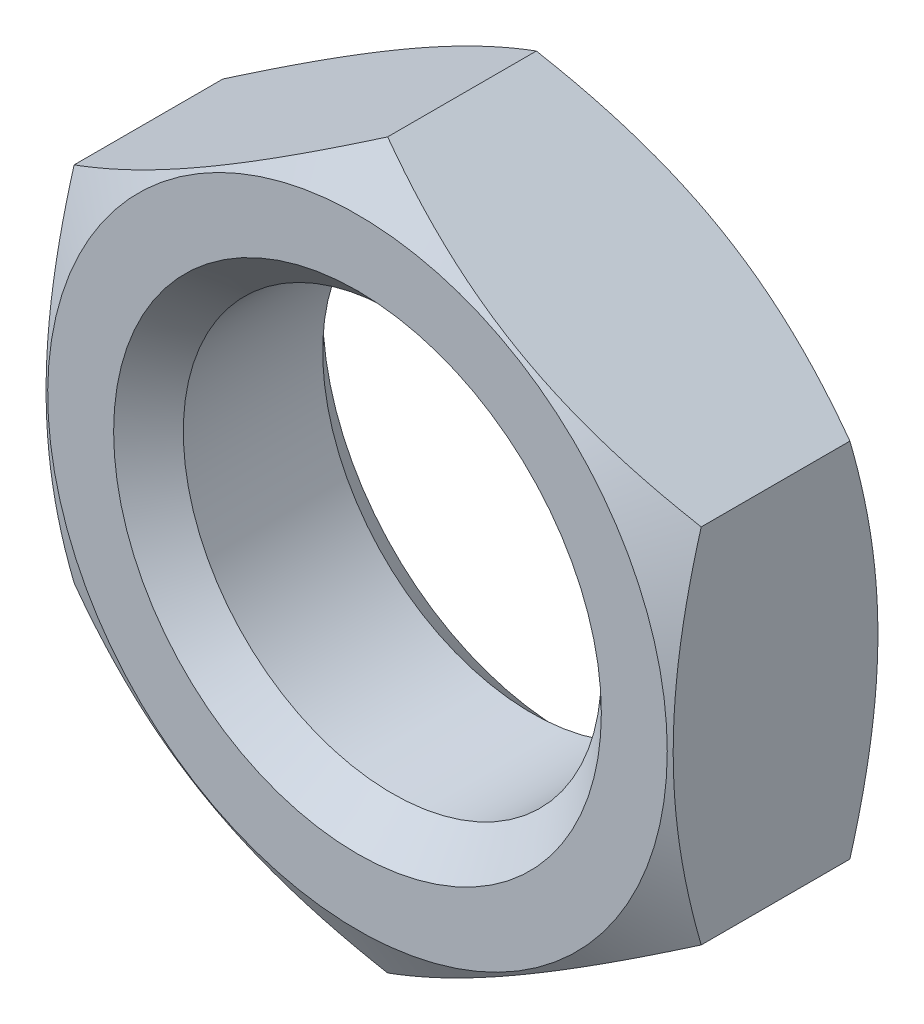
SolidWorks part; units mm, degrees
ref_plane "Front Plane" through (0, 0, 0) normal (0, 0, 1) x (1, 0, 0)
ref_plane "Top Plane" through (0, 0, 0) normal (0, 1, 0) x (1, 0, 0)
ref_plane "Right Plane" through (0, 0, 0) normal (1, 0, 0) x (0, 0, -1)
sketch "Sketch3" plane through (0, 0, 0) normal (0, 0, 1) x (1, 0, 0)
  line L1 (0, 15.5885) -> (-13.5, 7.7942)
  line L2 (-13.5, 7.7942) -> (-13.5, -7.7942)
  line L3 (-13.5, -7.7942) -> (0, -15.5885)
  line L4 (0, -15.5885) -> (13.5, -7.7942)
  line L5 (13.5, -7.7942) -> (13.5, 7.7942)
  line L6 (13.5, 7.7942) -> (0, 15.5885)
  circle A0 centre (0, 0) radius 13.5 construction
  dimension "D1" = 27
extrude "Boss-Extrude1" add sketch "Sketch3" along normal mid plane 9
sketch "Sketch4" plane through (0, 0, 0) normal (1, 0, 0) x (0, 0, -1)
  line L0 (-5.4578, 0) -> (6.1545, 0) construction
sketch "Sketch5" plane through (0, 0, 0) normal (1, 0, 0) x (0, 0, -1)
  line L0 (-4.5, 15.5885) -> (-4.5, 13.3385)
  line L1 (-4.5, 7.7942) -> (-4.5, 15.5885) construction
  line L2 (-4.5, 13.3385) -> (-3.201, 15.5885)
  line L3 (-4.5, 15.5885) -> (4.5, 15.5885) construction
  line L4 (-3.201, 15.5885) -> (-4.5, 15.5885)
  dimension "D1" = 2.25
  dimension "D2" = 30
revolve "Cut-Revolve1" cut sketch "Sketch5" angle 360 about L0
mirror "Mirror1" about plane through (0, 0, 0) normal (0, 0, 1) of "Cut-Revolve1"
sketch "Sketch6" plane through (0, 0, 4.5) normal (0, 0, 1) x (1, 0, 0)
  circle A0 centre (0, 0) radius 9
  dimension "D1" = 18
extrude "Cut-Extrude1" cut sketch "Sketch6" against normal blind 9
chamfer "Chamfer1" distance 1.5 angle 45 2 edges at (9, 0, -4.5) (9, 0, 4.5)
